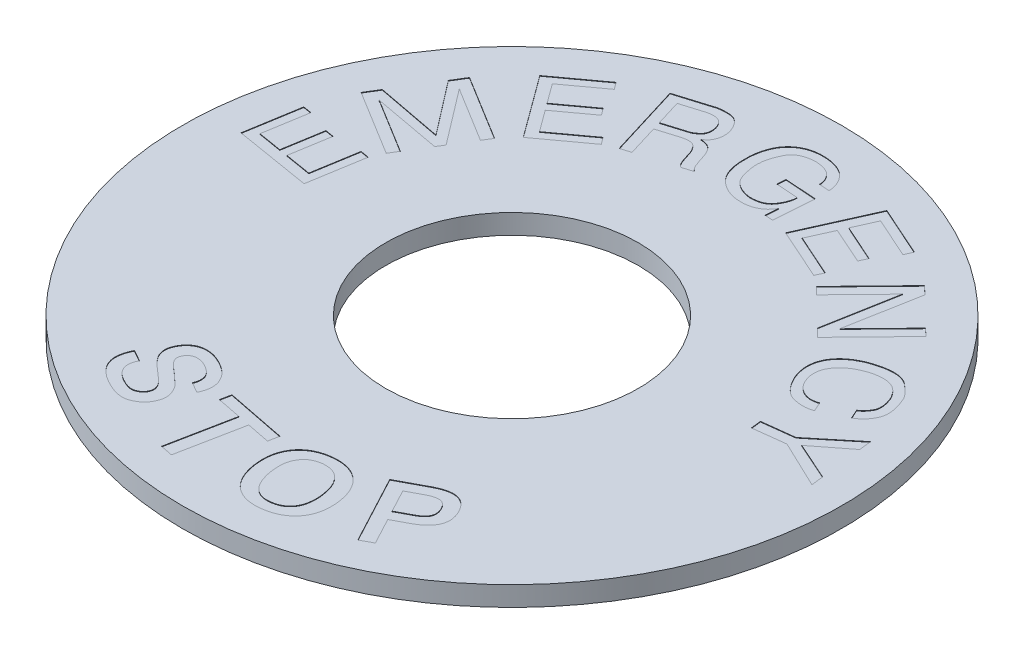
SolidWorks part; units mm, degrees
ref_plane "Спереди" through (0, 0, 0) normal (0, 0, 1) x (1, 0, 0)
ref_plane "Сверху" through (0, 0, 0) normal (0, 1, 0) x (1, 0, 0)
ref_plane "Справа" through (0, 0, 0) normal (1, 0, 0) x (0, 0, -1)
sketch "Эскиз1" plane through (0, 0, 0) normal (0, 0, 1) x (1, 0, 0)
  line L0 (11.5, 1.8) -> (11.5, 0)
  line L1 (11.5, 0) -> (30, 0)
  line L2 (30, 0) -> (30, 1.8)
  line L3 (30, 1.8) -> (11.5, 1.8)
  line L4 (0, 1.8) -> (0, 0) construction
revolve "Повернуть1" add sketch "Эскиз1" angle 360 about L4
sketch "Эскиз2" plane through (0, 1.8, 0) normal (0, 1, 0) x (1, 0, 0)
  circle A0 centre (0, 0) radius 20 construction
  circle A1 centre (0, 0) radius 27.0386 construction
  text T0 "EMERGENCY" font "PragmaticaC" height 7
extrude "Вырез-Вытянуть1" cut sketch "Эскиз2" against normal blind 0.05
sketch "Эскиз4" plane through (0, 1.8, 0) normal (0, 1, 0) x (1, 0, 0)
  arc A0 (-15.9693, -21.7711) -> (15.9693, -21.7711) centre (0, 0) ccw construction
  text T0 "STOP" font "Pragmatica" height 7
extrude "Вырез-Вытянуть2" cut sketch "Эскиз4" against normal blind 0.05
